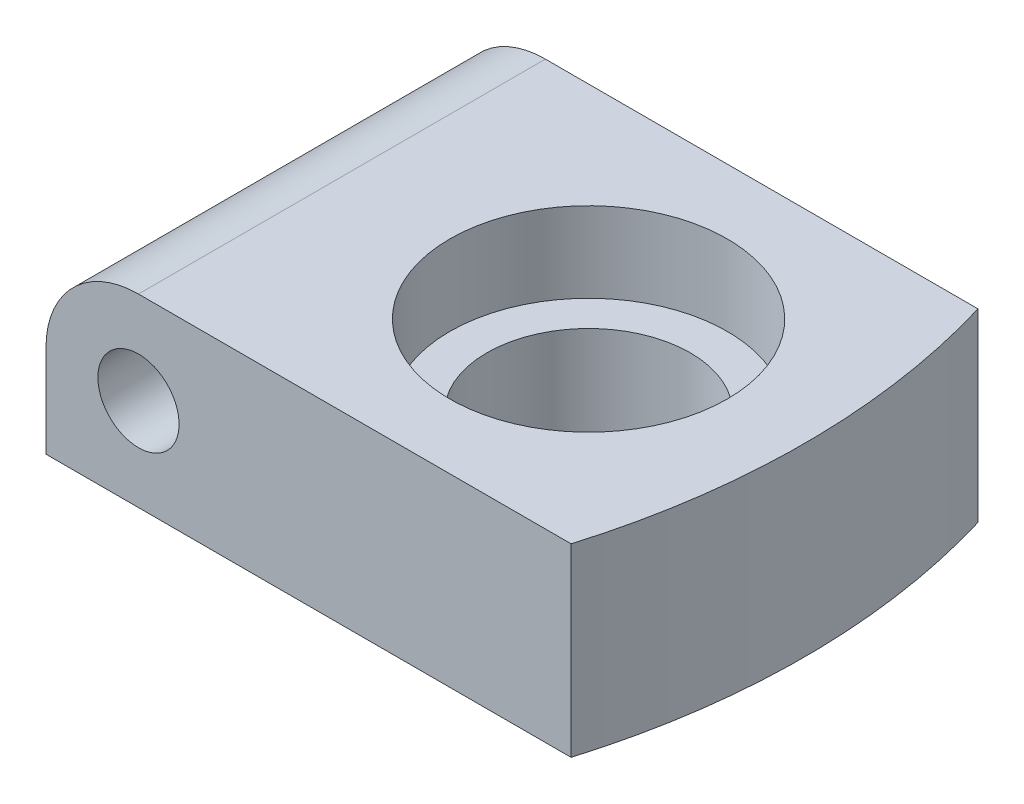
SolidWorks part; units mm, degrees
ref_plane "Front" through (0, 0, 0) normal (0, 0, 1) x (1, 0, 0)
ref_plane "Top" through (0, 0, 0) normal (0, 1, 0) x (1, 0, 0)
ref_plane "Right" through (0, 0, 0) normal (1, 0, 0) x (0, 0, -1)
sketch "Sketch2" plane through (0, 0, 0) normal (0, 1, 0) x (1, 0, 0)
  line L0 (40.1635, 33) -> (45, 33) construction
  line L1 (-45, -33) -> (40.1635, -33)
  line L2 (-45, -33) -> (-45, 33)
  line L3 (-45, 33) -> (40.1635, 33)
  line L4 (45, -33) -> (45, 33) construction
  line L5 (40.1635, -33) -> (45, -33) construction
  line L6 (-45, -33) -> (45, 33) construction
  arc A0 (40.1635, 33) -> (40.1635, -33) centre (-70, 0) cw
  dimension "D3" = 115
  dimension "D1" = 66
  dimension "D2" = 90
extrude "Extrude1" add sketch "Sketch2" along normal blind 30
fillet "Fillet1" radius 15
sketch "Sketch3" plane through (0, 0, 0) normal (0, 0, 1) x (1, 0, 0)
  line L0 (10, 33.2731) -> (10, -5.415) construction
  line L1 (-45, 15) -> (-45, 0) construction
  line L2 (10, 30) -> (32.5, 30)
  line L3 (-30, 30) -> (40.1635, 30) construction
  line L4 (32.5, 30) -> (32.5, 17)
  line L5 (32.5, 17) -> (26.5, 17)
  line L6 (26.5, 17) -> (26.5, 0)
  line L7 (-45, 0) -> (40.1635, 0) construction
  line L8 (26.5, 0) -> (10, 0)
  line L9 (10, 0) -> (10, 30)
  dimension "D1" = 55
  dimension "D2" = 45
  dimension "D3" = 33
  dimension "D4" = 13
revolve "Cut-Revolve1" cut sketch "Sketch3" angle 360 about L0
ref_plane "Plane1" through (0, 0, 50) normal (0, 0, 1) x (1, 0, 0)
ref_plane "Plane2" through (0, 0, -50) normal (0, 0, 1) x (1, 0, 0)
sketch "Sketch4" plane through (0, 0, -50) normal (0, 0, 1) x (1, 0, 0)
  circle A0 centre (-30, 15) radius 7
  arc A1 (-30, 30) -> (-45, 15) centre (-30, 15) ccw construction
  dimension "D1" = 14
sketch "Sketch5" plane through (0, 0, 50) normal (0, 0, 1) x (1, 0, 0)
  circle A0 centre (-30, 15) radius 6.5
  dimension "D1" = 13
loft "Cut-Loft1" cut profiles "Sketch4", "Sketch5"
